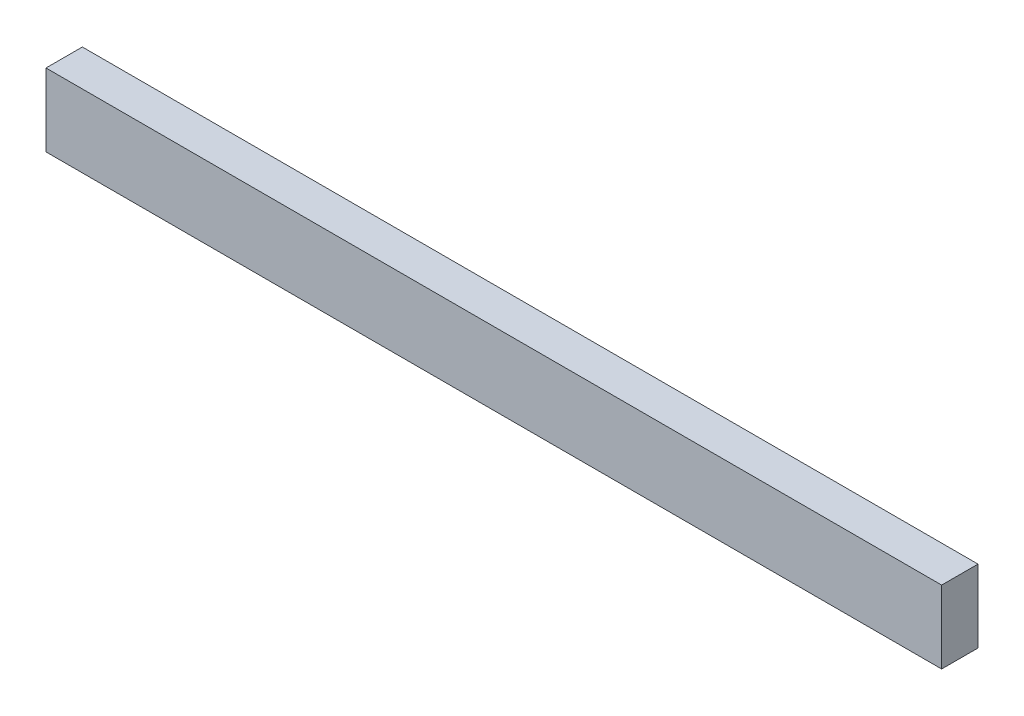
SolidWorks part; units mm, degrees
ref_plane "Piano frontale" through (0, 0, 0) normal (0, 0, 1) x (1, 0, 0)
ref_plane "Piano superiore" through (0, 0, 0) normal (0, 1, 0) x (1, 0, 0)
ref_plane "Piano destro" through (0, 0, 0) normal (1, 0, 0) x (0, 0, -1)
sketch "Sketch1" plane through (0, 0, 0) normal (0, 0, 1) x (1, 0, 0)
  line L1 (-13.1249, -3.6686) -> (11.5151, -3.6686)
  line L2 (-13.1249, -3.6686) -> (-13.1249, -1.6686)
  line L3 (-13.1249, -1.6686) -> (11.5151, -1.6686)
  line L4 (11.5151, -3.6686) -> (11.5151, -1.6686)
  dimension "D1" = 24.64
  dimension "D2" = 2
extrude "Boss-Extrude1" add sketch "Sketch1" along normal blind 1
